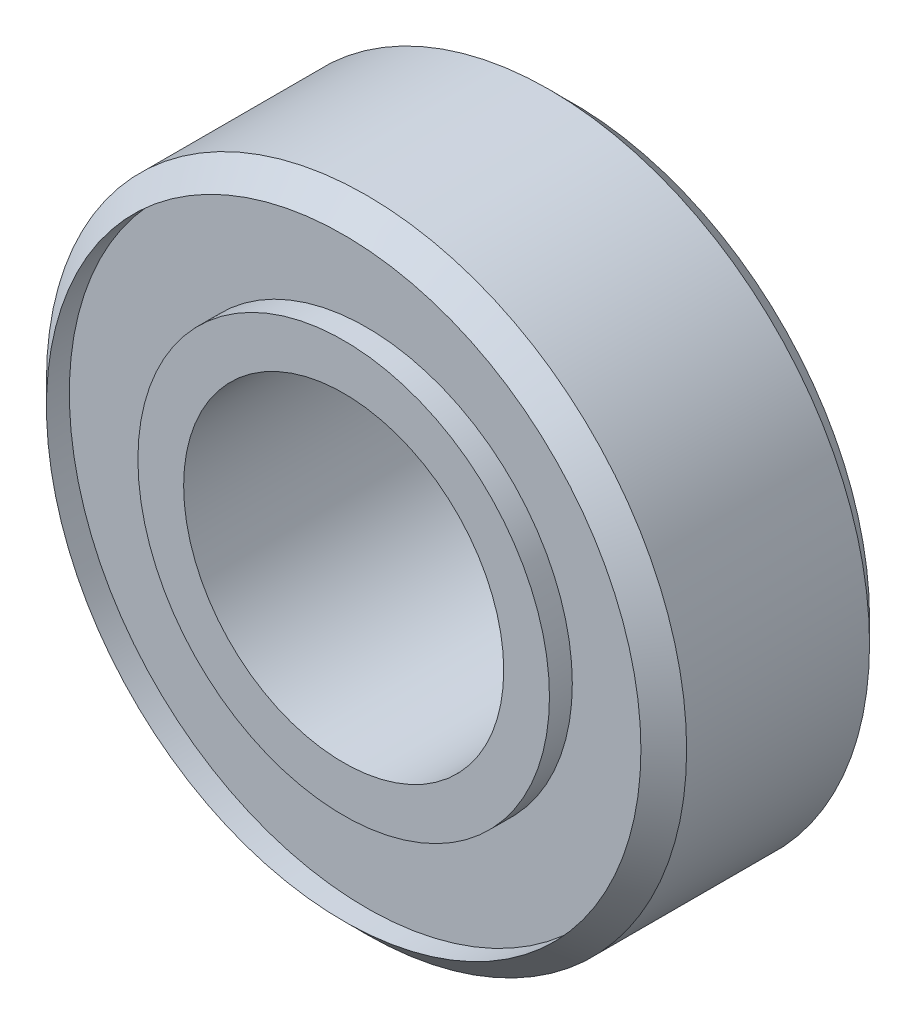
SolidWorks part; units mm, degrees
ref_plane "Plan1" through (0, 0, 0) normal (0, 0, 1) x (1, 0, 0)
ref_plane "Plan2" through (0, 0, 0) normal (0, 1, 0) x (1, 0, 0)
ref_plane "Plan3" through (0, 0, 0) normal (1, 0, 0) x (0, 0, -1)
sketch "Esquisse1" plane through (0, 0, 0) normal (0, 0, 1) x (1, 0, 0)
  circle A0 centre (0, 0) radius 7
  circle A1 centre (0, 0) radius 3.5
  dimension "D1" = 14
  dimension "D2" = 7
extrude "Base-Extrusion" add sketch "Esquisse1" along normal blind 5
chamfer "Chanfrein1" distance 0.5 angle 45 2 edges at (7, 0, 0) (7, 0, 5)
sketch "Esquisse2" plane through (0, 0, 5) normal (0, 0, 1) x (1, 0, 0)
  circle A0 centre (0, 0) radius 6.5
  circle A1 centre (0, 0) radius 4.5
  dimension "D1" = 13
  dimension "D2" = 9
extrude "Enlèv. mat.-Extru.1" cut sketch "Esquisse2" against normal blind 0.5
sketch "Esquisse3" plane through (0, 0, 0) normal (0, 0, -1) x (-1, 0, 0)
  circle A0 centre (0, 0) radius 4.5
  circle A1 centre (0, 0) radius 6.5
  dimension "D1" = 13
  dimension "D2" = 9
extrude "Enlèv. mat.-Extru.2" cut sketch "Esquisse3" against normal blind 0.5
